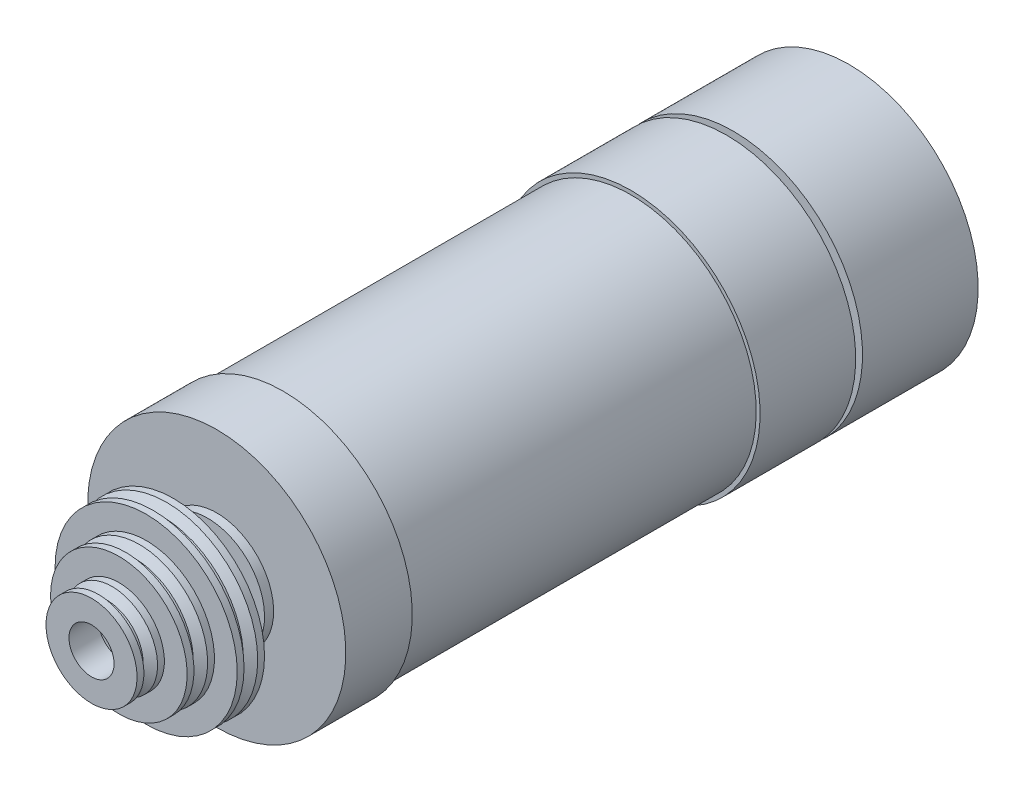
SolidWorks part; units mm, degrees
ref_plane "Front Plane" through (0, 0, 0) normal (0, 0, 1) x (1, 0, 0)
ref_plane "Top Plane" through (0, 0, 0) normal (0, 1, 0) x (1, 0, 0)
ref_plane "Right Plane" through (0, 0, 0) normal (1, 0, 0) x (0, 0, -1)
sketch "Sketch2" plane through (0, 0, 0) normal (1, 0, 0) x (0, 0, -1)
  line L0 (-96.9504, 0) -> (96.9504, 0) construction
  line L1 (-77, 0) -> (-77, 4.95)
  line L2 (56, 10) -> (57.5, 10)
  line L3 (-77, 4.95) -> (-58, 4.95)
  line L4 (-58, 4.95) -> (-58, 12.5)
  line L5 (-58, 12.5) -> (-56, 12.5)
  line L6 (-56, 12.5) -> (-56, 28.35)
  line L7 (-56, 28.35) -> (-41.4, 28.35)
  line L8 (-41.4, 28.35) -> (-41.4, 27.5)
  line L9 (-41.4, 27.5) -> (35, 27.5)
  line L10 (35, 27.5) -> (35, 28.35)
  line L11 (35, 28.35) -> (56, 28.35)
  line L12 (56, 28.35) -> (56, 10)
  line L13 (57.5, 10) -> (57.5, 28.35)
  line L14 (57.5, 28.35) -> (82.9, 28.35)
  line L15 (82.9, 28.35) -> (82.9, 4.95)
  line L16 (82.9, 4.95) -> (85.7, 4.95)
  line L17 (85.7, 4.95) -> (85.7, 0)
  line L18 (-77, 0) -> (85.7, 0)
  point P4 (0, 0)
  dimension "D1" = 4.95
  dimension "D2" = 19
  dimension "D3" = 2
  dimension "D4" = 14.6
  dimension "D5" = 28.35
  dimension "D6" = 27.5
  dimension "D7" = 12.5
  dimension "D8" = 56
  dimension "D9" = 56
  dimension "D10" = 21
  dimension "D11" = 28.35
  dimension "D12" = 10
  dimension "D13" = 25.4
  dimension "D14" = 1.5
  dimension "D15" = 29.7
  dimension "D16" = 28.35
  dimension "D17" = 4.95
revolve "Revolve1" add sketch "Sketch2" angle 360 about L0
sketch "Sketch3" plane through (0, 0, 0) normal (1, 0, 0) x (0, 0, -1)
  line L0 (0, 0) -> (-94.2386, 0) construction
  line L1 (-83.5, 4.95) -> (-58.5, 4.95)
  line L3 (-65.5, 20) -> (-67, 20)
  line L4 (-67, 20) -> (-68.1547, 18)
  line L5 (-68.1547, 18) -> (-68.8453, 18)
  line L6 (-68.8453, 18) -> (-70, 20)
  line L7 (-70, 20) -> (-71.5, 20)
  line L8 (-71.5, 20) -> (-71.5, 15)
  line L9 (-71.5, 15) -> (-73, 15)
  line L10 (-73, 15) -> (-74.1547, 13)
  line L11 (-74.1547, 13) -> (-74.8453, 13)
  line L12 (-74.8453, 13) -> (-76, 15)
  line L13 (-76, 15) -> (-77.5, 15)
  line L15 (-65.5, 20) -> (-65.5, 9)
  line L16 (-65.5, 9) -> (-58.5, 9)
  line L17 (-58.5, 9) -> (-58.5, 4.95)
  line L18 (-77.5, 15) -> (-77.5, 10)
  line L19 (-58, 12.5) -> (-58, -12.5) construction
  line L20 (-77.5, 10) -> (-79, 10)
  line L21 (-79, 10) -> (-80.1547, 8)
  line L22 (-80.1547, 8) -> (-80.8453, 8)
  line L23 (-80.8453, 8) -> (-82, 10)
  line L24 (-82, 10) -> (-83.5, 10)
  line L25 (-83.5, 10) -> (-83.5, 4.95)
  point P22 (-66.25, 20)
  dimension "D1" = 60
  dimension "D2" = 60
  dimension "D3" = 3
  dimension "D4" = 1.5
  dimension "D5" = 10
  dimension "D6" = 2
  dimension "D8" = 4.95
  dimension "D9" = 7
  dimension "D10" = 15
  dimension "D11" = 20
  dimension "D12" = 9
  dimension "D13" = 0.5
revolve "Revolve2" add sketch "Sketch3" angle 360 about L0
combine bodies "Combine1" operation type add bodies to combine 101 102
